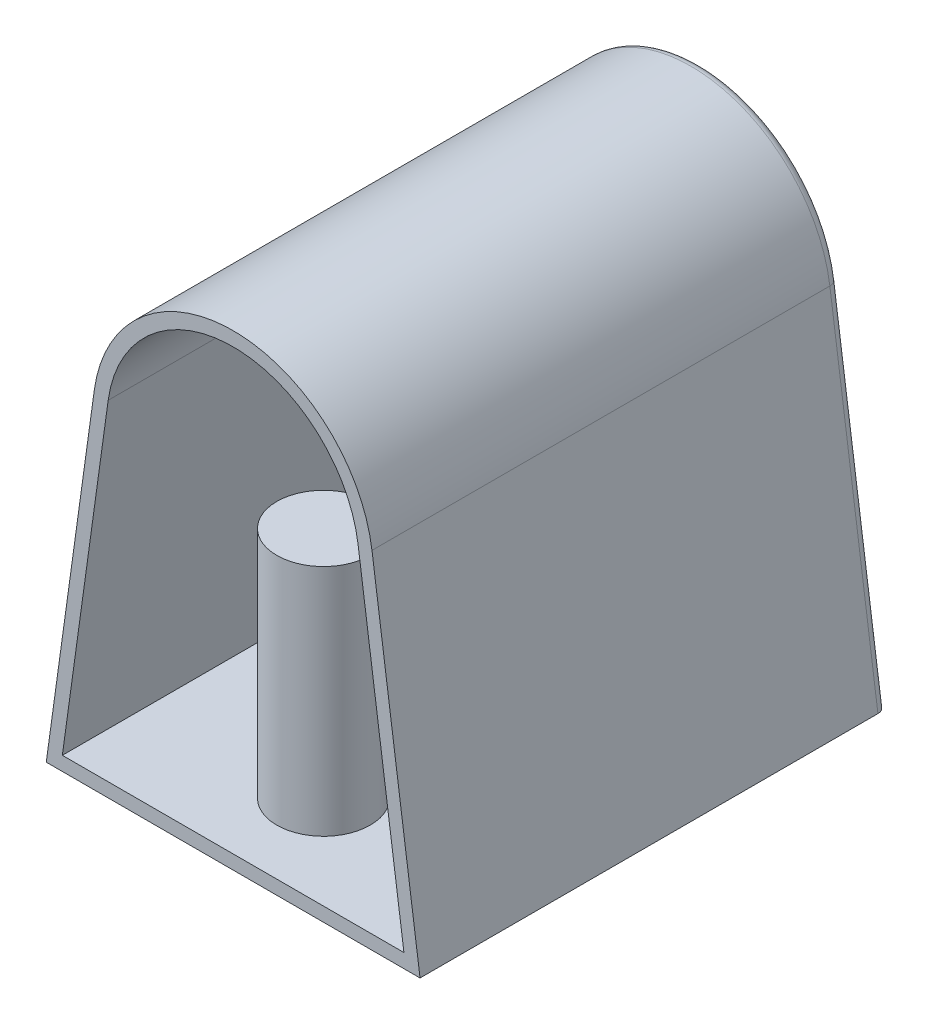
SolidWorks part; units mm, degrees
ref_plane "Front Plane" through (0, 0, 0) normal (0, 0, 1) x (1, 0, 0)
ref_plane "Top Plane" through (0, 0, 0) normal (0, 1, 0) x (1, 0, 0)
ref_plane "Right Plane" through (0, 0, 0) normal (1, 0, 0) x (0, 0, -1)
sketch "Sketch1" plane through (0, 0, 0) normal (0, 0, 1) x (1, 0, 0)
  line L0 (0, 0) -> (0, 500) construction
  line L1 (0, 500) -> (0, 350) construction
  line L2 (0, 0) -> (200, 0)
  line L3 (0, 0) -> (-200, 0)
  line L4 (-200, 0) -> (-148.5766, 370.6152)
  line L6 (200, 0) -> (148.5766, 370.6152)
  arc A0 (148.5766, 370.6152) -> (-148.5766, 370.6152) centre (0, 350) ccw
  dimension "D1" = 500
  dimension "D2" = 150
  dimension "D3" = 400
  dimension "D4" = 200
extrude "Boss-Extrude1" add sketch "Sketch1" along normal blind 500
sketch "Sketch2" plane through (0, 0, 0) normal (0, 0, 1) x (1, 0, 0)
  line L14 (125.7748, 230) -> (-124.2252, 230)
  line L15 (125.7748, 230) -> (125.7748, 330)
  line L16 (125.7748, 330) -> (-124.2252, 330)
  line L17 (-124.2252, 230) -> (-124.2252, 330)
  line L18 (125.7748, 230) -> (-124.2252, 330) construction
  line L19 (125.7748, 330) -> (-124.2252, 230) construction
  point P7 (0.7748, 280)
  dimension "D1" = 250
  dimension "D2" = 50
  dimension "D3" = 280
extrude "Cut-Extrude1" cut sketch "Sketch2" along normal blind 25
fillet "Fillet2" radius 10 4 edges at (-124.2252, 280, 0) (0.7748, 330, 0) (0.7748, 230, 0) (125.7748, 280, 0)
sketch "Sketch3" plane through (0, 0, 25) normal (0, 0, -1) x (-1, 0, 0)
  line L0 (0, 0) -> (-0.7748, 330) construction
  line L1 (-125.7748, 330) -> (124.2252, 330) construction
  line L2 (-0.7748, 330) -> (124.2252, 330)
  line L3 (124.2252, 330) -> (124.2252, 230)
  line L4 (-0.7748, 330) -> (-125.7748, 330)
  line L5 (-125.7748, 330) -> (-125.7748, 230)
  line L6 (-125.7748, 230) -> (124.2252, 230)
extrude "Boss-Extrude2" add sketch "Sketch3" along normal blind 15
sketch "Sketch4" plane through (0, 0, 0) normal (0, 0, -1) x (-1, 0, 0)
  line L3 (-140.1494, 95) -> (139.8506, 95)
  line L4 (-140.1494, 95) -> (-140.1494, 15)
  line L5 (-140.1494, 15) -> (139.8506, 15)
  line L6 (139.8506, 95) -> (139.8506, 15)
  line L7 (-140.1494, 95) -> (139.8506, 15) construction
  line L8 (-140.1494, 15) -> (139.8506, 95) construction
  point P4 (-0.1494, 55)
  dimension "D1" = 80
  dimension "D2" = 280
  dimension "D3" = 55
extrude "Cut-Extrude2" cut sketch "Sketch4" against normal blind 150
sketch "Sketch5" plane through (0, 0, 0) normal (0, 0, -1) x (-1, 0, 0)
  line L0 (-0.1494, 95) -> (-0.7748, 220) construction
  line L2 (139.8506, 95) -> (-140.1494, 95) construction
  line L3 (134.2252, 220) -> (-135.7748, 220) construction
  circle A0 centre (-0.4621, 157.5) radius 22.5
  dimension "D1" = 45
extrude "Boss-Extrude3" add sketch "Sketch5" along normal blind 5
fillet "Fillet3" radius 5 1 edges at (-22.0379, 157.5, -5)
sketch "Sketch6" plane through (0, 0, 0) normal (0, 0, -1) x (-1, 0, 0)
  line L0 (-0.4621, 157.5) -> (44.5379, 157.5) construction
  line L1 (-0.4621, 157.5) -> (-45.4621, 157.5) construction
  line L2 (-0.4621, 157.5) -> (-0.4621, 112.5) construction
  line L3 (-0.4621, 157.5) -> (-0.4621, 202.5) construction
  circle A0 centre (44.5379, 157.5) radius 15
  circle A1 centre (-45.4621, 157.5) radius 15
  circle A2 centre (-0.4621, 112.5) radius 15
  circle A3 centre (-0.4621, 202.5) radius 15
  dimension "D3" = 30
  dimension "D4" = 30
  dimension "D6" = 30
  dimension "D7" = 30
  dimension "D1" = 45
  dimension "5" = 45
  dimension "D2" = 45
  dimension "D5" = 45
extrude "Boss-Extrude4" add sketch "Sketch6" along normal blind 5
fillet "Fillet4" radius 5 2 edges at (-59.5379, 157.5, -5) (30.4621, 157.5, -5)
fillet "Fillet5" radius 5 2 edges at (-14.5379, 112.5, -5) (-14.5379, 202.5, -5)
sketch "Sketch8" plane through (0, 0, -5) normal (0, 0, -1) x (-1, 0, 0)
  line L0 (-45.4621, 157.5) -> (-55.4621, 157.5) construction
  line L1 (-45.4621, 157.5) -> (-35.4621, 157.5) construction
  line L2 (-40.4621, 152.9561) -> (-40.4621, 162.0439)
  line L3 (-40.4621, 162) -> (-40.4621, 153)
  line L4 (-50.6582, 157.5) -> (-40.4621, 162.0439)
  line L5 (-50.6582, 157.5) -> (-40.4621, 153)
  line L6 (-35.4621, 157.5) -> (54.5379, 157.5) construction
  line L7 (-50.6582, 157.5) -> (-40.4621, 162)
  line L8 (-50.6582, 157.5) -> (-40.4621, 152.9561)
  line L9 (34.5379, 157.5) -> (44.5379, 157.5) construction
  line L10 (39.5379, 157.5) -> (39.5379, 162)
  line L11 (39.5379, 157.5) -> (39.5379, 153)
  line L12 (39.5379, 162) -> (49.5379, 157.5)
  line L13 (49.5379, 157.5) -> (39.5379, 153)
  line L14 (-0.4621, 192.5) -> (-0.4621, 212.5) construction
  line L15 (-0.4621, 122.5) -> (-0.4621, 102.5) construction
  line L16 (-0.4621, 197.5) -> (4.0379, 197.5)
  line L17 (-0.4621, 197.5) -> (-4.9621, 197.5)
  line L18 (-0.4621, 117.5) -> (4.5379, 117.5)
  line L19 (-0.4621, 117.5) -> (-4.9621, 117.5)
  line L22 (-0.4621, 107.5) -> (4.5379, 117.5)
  line L23 (-0.4621, 107.5) -> (-4.9621, 117.5)
  line L24 (-4.9621, 197.5) -> (-0.4621, 207.5)
  line L25 (-0.4621, 207.5) -> (4.0379, 197.5)
  circle A0 centre (-45.4621, 157.5) radius 10 construction
  circle A1 centre (44.5379, 157.5) radius 10 construction
  circle A2 centre (-0.4621, 202.5) radius 10 construction
  circle A3 centre (-0.4621, 112.5) radius 10 construction
  point P8 (-50.6582, 157.5)
  point P17 (-40.4621, 157.5)
  point P19 (39.5379, 157.5)
  point P22 (49.5379, 157.5)
  point P35 (-0.4621, 207.5)
  point P36 (-0.4621, 197.5)
  point P37 (-0.4621, 117.5)
  point P38 (-0.4621, 107.5)
  dimension "D1" = 4.5439
  dimension "D2" = 4.5
  dimension "D3" = 11.1628
  dimension "D4" = 5
  dimension "D5" = 4.5
  dimension "D6" = 4.5
  dimension "D7" = 5
  dimension "D8" = 5
  dimension "D9" = 5
  dimension "D10" = 5
  dimension "D11" = 5
  dimension "D12" = 4.5
  dimension "D13" = 4.5
  dimension "D14" = 4.5
  dimension "D15" = 5
extrude "Boss-Extrude6" add sketch "Sketch8" along normal blind 1
fillet "Fillet6" radius 10 3 edges at (174.2883, 185.3076, 0) (-174.2883, 185.3076, 0) (0, 500, 0)
sketch "Sketch9" plane through (0, 0, 150) normal (0, 0, -1) x (-1, 0, 0)
  line L4 (139.8506, 15) -> (139.8506, 95)
  line L5 (139.8506, 95) -> (-140.1494, 95)
  line L6 (-140.1494, 95) -> (-140.1494, 15)
  line L7 (-140.1494, 15) -> (139.8506, 15)
  line L8 (139.8506, 15) -> (139.8506, 95)
  line L9 (139.8506, 95) -> (-140.1494, 95)
  line L10 (-140.1494, 95) -> (-140.1494, 15)
  line L11 (-140.1494, 15) -> (139.8506, 15)
  dimension "D1" = 0
extrude "Boss-Extrude7" add sketch "Sketch9" along normal blind 150
sketch "Sketch10" plane through (0, 0, 500) normal (0, 0, 1) x (1, 0, 0)
  line L3 (-200, 0) -> (200, 0)
  line L4 (200, 0) -> (148.5766, 370.6152)
  line L5 (-148.5766, 370.6152) -> (-200, 0)
  line L6 (-200, 0) -> (200, 0)
  line L7 (200, 0) -> (148.5766, 370.6152)
  line L8 (-148.5766, 370.6152) -> (-200, 0)
  line L9 (-133.719, 368.5537) -> (-182.775, 15)
  line L10 (-182.775, 15) -> (182.775, 15)
  line L11 (182.775, 15) -> (133.719, 368.5537)
  arc A1 (148.5766, 370.6152) -> (-148.5766, 370.6152) centre (0, 350) ccw
  arc A2 (148.5766, 370.6152) -> (-148.5766, 370.6152) centre (0, 350) ccw
  arc A3 (133.719, 368.5537) -> (-133.719, 368.5537) centre (0, 350) ccw
  dimension "D1" = 0
  dimension "D3" = 15
extrude "Cut-Extrude3" cut sketch "Sketch10" against normal blind 389 contours A3 L9 L10 L11
sketch "Sketch11" plane through (0, 0, 0) normal (0, 0, -1) x (-1, 0, 0)
  line L0 (0, 0) -> (0, 50) construction
  line L2 (-140, 75) -> (140, 75)
  line L3 (-140, 75) -> (-140, 25)
  line L4 (-140, 25) -> (140, 25)
  line L5 (140, 75) -> (140, 25)
  line L6 (-140, 75) -> (140, 25) construction
  line L7 (-140, 25) -> (140, 75) construction
  dimension "D1" = 50
  dimension "D2" = 50
  dimension "D3" = 280
extrude "Boss-Extrude8" add sketch "Sketch11" against normal blind 150
sketch "Sketch18" plane through (0, 0, 150) normal (0, 0, 1) x (1, 0, 0)
  line L0 (135, 70) -> (-135, 70)
  line L1 (-135, 70) -> (-135, 30)
  line L2 (-135, 30) -> (135, 30)
  line L3 (135, 30) -> (135, 70)
  line L4 (-140, 75) -> (-140, 25)
  line L5 (-140, 25) -> (140, 25)
  line L6 (140, 25) -> (140, 75)
  line L7 (140, 75) -> (-140, 75)
  line L8 (-140, 75) -> (-140, 25)
  line L9 (-140, 25) -> (140, 25)
  line L10 (140, 25) -> (140, 75)
  line L11 (140, 75) -> (-140, 75)
  dimension "D1" = 0
  dimension "D2" = 5
extrude "Cut-Extrude8" cut sketch "Sketch18" against normal blind 349 contours L0 L1 L2 L3
sketch "Sketch19" plane through (0, 75, 0) normal (0, 1, 0) x (1, 0, 0)
  line L0 (-135, -16) -> (-135, -145)
  line L1 (-135, -145) -> (135, -145)
  line L2 (135, -145) -> (135, -16)
  line L3 (135, -16) -> (-135, -16)
extrude "Cut-Extrude10" cut sketch "Sketch19" against normal blind 16
sketch "Sketch21" plane through (0, 75, 0) normal (0, 1, 0) x (1, 0, 0)
  line L0 (-135, -145) -> (135, -145)
  line L1 (135, -145) -> (135, -151.0408)
  line L2 (135, -151.0408) -> (-135, -150)
  line L3 (-140, -150) -> (140, -150) construction
  line L4 (-135, -150) -> (-135, -145)
extrude "Cut-Extrude11" cut sketch "Sketch21" against normal blind 16
sketch "Sketch22" plane through (0, 15, 0) normal (0, 1, 0) x (1, 0, 0)
  line L0 (-3.2794, -500) -> (-3.2794, -400) construction
  line L1 (-182.775, -500) -> (182.775, -500) construction
  circle A0 centre (-3.2794, -400) radius 50
  dimension "D2" = 100
  dimension "D1" = 100
extrude "Boss-Extrude9" add sketch "Sketch22" along normal blind 250
